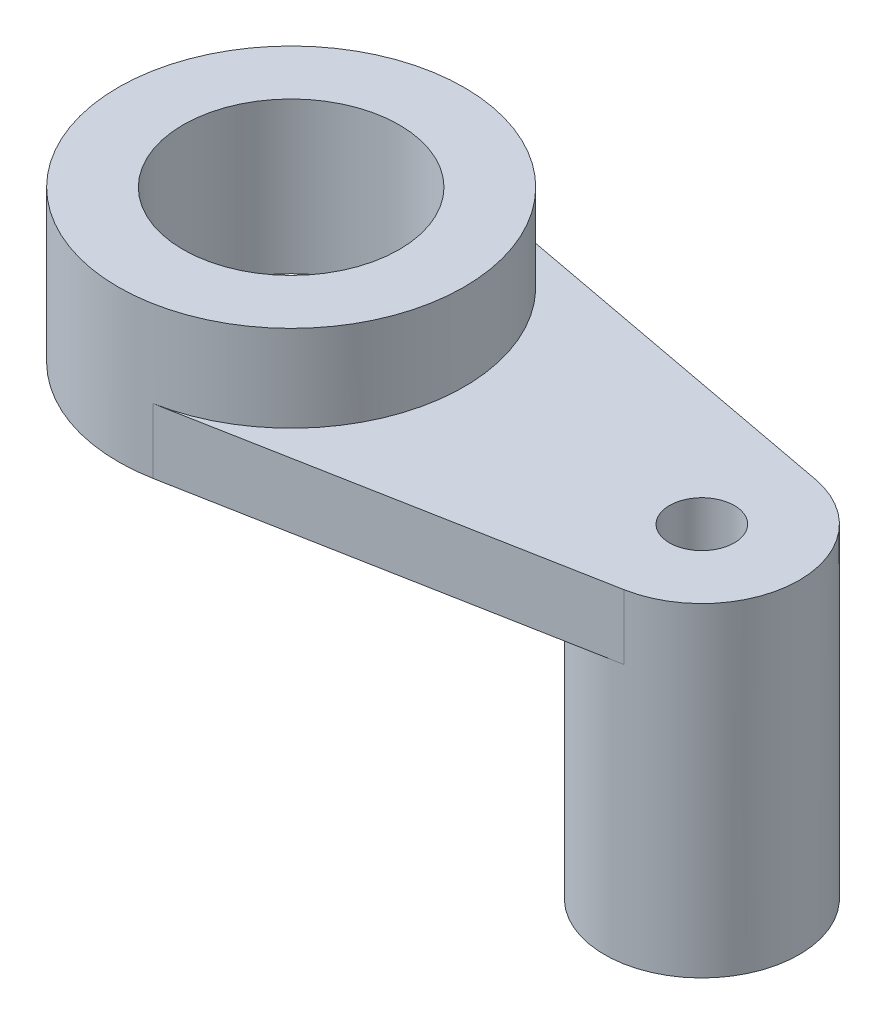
SolidWorks part; units mm, degrees
ref_plane "Front Plane" through (0, 0, 0) normal (0, 0, 1) x (1, 0, 0)
ref_plane "Top Plane" through (0, 0, 0) normal (0, 1, 0) x (1, 0, 0)
ref_plane "Right Plane" through (0, 0, 0) normal (1, 0, 0) x (0, 0, -1)
sketch "Sketch1" plane through (0, 0, 0) normal (0, 1, 0) x (1, 0, 0)
  line L0 (2.9474, -15.7262) -> (39.6579, -8.846)
  line L1 (0, 0) -> (38, 0) construction
  line L2 (2.9474, 15.7262) -> (39.6579, 8.846)
  circle A0 centre (0, 0) radius 16
  circle A1 centre (38, 0) radius 9
  circle A2 centre (0, 0) radius 10
  circle A3 centre (38, 0) radius 3
  dimension "D1" = 32
  dimension "D2" = 18
  dimension "D3" = 38
extrude "Boss-Extrude1" add sketch "Sketch1" along normal blind 6
sketch "Sketch5" plane through (0, 6, 0) normal (0, 1, 0) x (1, 0, 0)
  circle A0 centre (0, 0) radius 16
  dimension "D1" = 32
extrude "Boss-Extrude4" add sketch "Sketch5" along normal blind 8
sketch "Sketch6" plane through (0, 14, 0) normal (0, 1, 0) x (1, 0, 0)
  circle A0 centre (0, 0) radius 10
extrude "Cut-Extrude1" cut sketch "Sketch6" against normal through all
sketch "Sketch7" plane through (0, 0, 0) normal (0, -1, 0) x (1, 0, 0)
  circle A0 centre (38, 0) radius 9
  dimension "D1" = 18
extrude "Boss-Extrude6" add sketch "Sketch7" along normal blind 24
sketch "Sketch8" plane through (0, -24, 0) normal (0, -1, 0) x (1, 0, 0)
  circle A0 centre (38, 0) radius 3
extrude "Cut-Extrude2" cut sketch "Sketch8" against normal through all
